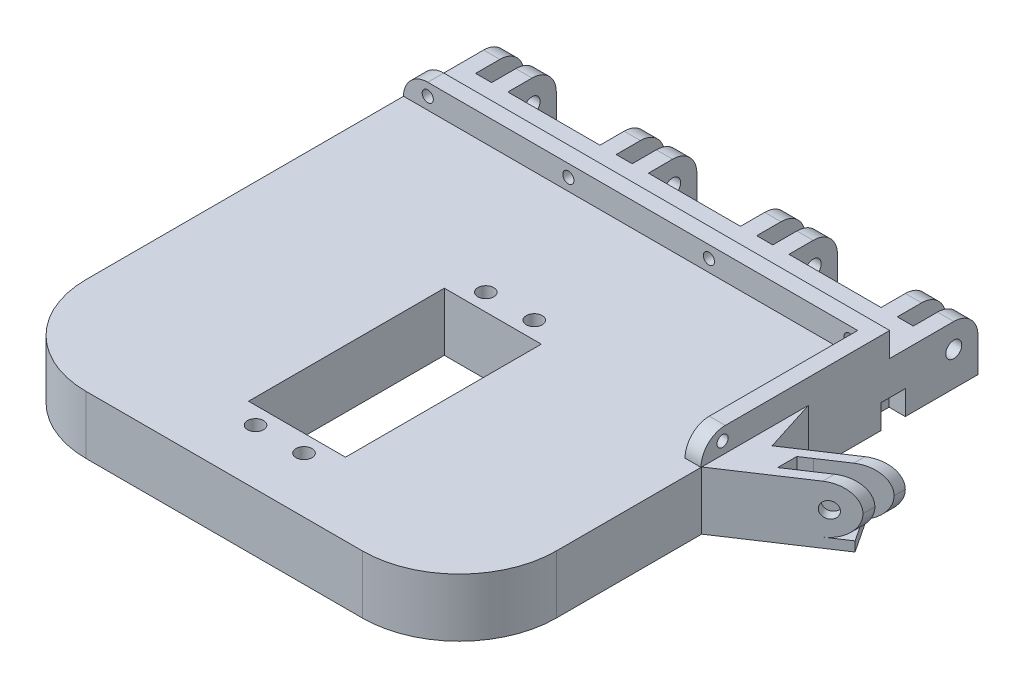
SolidWorks part; units mm, degrees
ref_plane "Front Plane" through (0, 0, 0) normal (0, 0, 1) x (1, 0, 0)
ref_plane "Top Plane" through (0, 0, 0) normal (0, 1, 0) x (1, 0, 0)
ref_plane "Right Plane" through (0, 0, 0) normal (1, 0, 0) x (0, 0, -1)
sketch "Sketch1" plane through (0, 0, 0) normal (0, 1, 0) x (1, 0, 0)
  line L1 (0, 0) -> (97, 0)
  line L2 (0, 0) -> (0, 97)
  line L3 (0, 97) -> (97, 97)
  line L4 (97, 0) -> (97, 97)
  line L5 (38.5, 15) -> (58.5, 15)
  line L6 (38.5, 15) -> (38.5, 55.4)
  line L7 (38.5, 55.4) -> (58.5, 55.4)
  line L8 (58.5, 15) -> (58.5, 55.4)
  circle A0 centre (43.5, 58.95) radius 1.65
  circle A1 centre (53.5, 58.95) radius 1.65
  circle A2 centre (43.5, 11.45) radius 1.65
  circle A3 centre (53.5, 11.45) radius 1.65
  dimension "D7" = 3.55
  dimension "D8" = 3.3
  dimension "D9" = 3.3
  dimension "D11" = 3.3
  dimension "D12" = 3.3
  dimension "D15" = 10
  dimension "D1" = 97
  dimension "D2" = 97
  dimension "D3" = 40.4
  dimension "D4" = 15
  dimension "D5" = 20
  dimension "D6" = 38.5
  dimension "D10" = 3.55
  dimension "D13" = 3.55
  dimension "D14" = 3.55
  dimension "D16" = 10
  dimension "D17" = 5
  dimension "D18" = 5
extrude "Boss-Extrude1" add sketch "Sketch1" along normal blind 10
sketch "Sketch2" plane through (0, 0, -97) normal (0, 0, -1) x (-1, 0, 0)
  line L0 (-97, 0) -> (0, 0) construction
  line L1 (-97, 10) -> (-93.65, 10)
  line L2 (-97, 10) -> (-97, 0)
  line L3 (-97, 0) -> (-93.65, 0)
  line L4 (-93.65, 10) -> (-93.65, 0)
  line L5 (-97, 10) -> (0, 10) construction
  line L6 (-90.35, 10) -> (-87, 10)
  line L7 (-90.35, 10) -> (-90.35, 0)
  line L8 (-90.35, 0) -> (-87, 0)
  line L9 (-87, 10) -> (-87, 0)
  line L11 (-68, 10) -> (-64.65, 10)
  line L12 (-68, 10) -> (-68, 0)
  line L13 (-68, 0) -> (-64.65, 0)
  line L14 (-64.65, 10) -> (-64.65, 0)
  line L15 (-61.35, 10) -> (-58, 10)
  line L16 (-61.35, 10) -> (-61.35, 0)
  line L17 (-61.35, 0) -> (-58, 0)
  line L18 (-58, 10) -> (-58, 0)
  line L19 (-39, 10) -> (-35.65, 10)
  line L20 (-39, 10) -> (-39, 0)
  line L21 (-39, 0) -> (-35.65, 0)
  line L22 (-35.65, 10) -> (-35.65, 0)
  line L23 (-32.35, 10) -> (-29, 10)
  line L24 (-32.35, 10) -> (-32.35, 0)
  line L25 (-32.35, 0) -> (-29, 0)
  line L26 (-29, 10) -> (-29, 0)
  line L27 (0, 10) -> (-3.35, 10)
  line L28 (0, 10) -> (0, 0)
  line L29 (0, 0) -> (-3.35, 0)
  line L30 (-3.35, 10) -> (-3.35, 0)
  line L31 (-6.65, 10) -> (-10, 10)
  line L32 (-6.65, 10) -> (-6.65, 0)
  line L33 (-6.65, 0) -> (-10, 0)
  line L34 (-10, 10) -> (-10, 0)
  dimension "D1" = 3.3
  dimension "D2" = 3.35
  dimension "D3" = 3.35
  dimension "D4" = 19
  dimension "D5" = 3.35
  dimension "D6" = 3.3
  dimension "D7" = 3.35
  dimension "D8" = 19
  dimension "D9" = 3.35
  dimension "D10" = 3.3
  dimension "D11" = 3.35
  dimension "D12" = 3.35
  dimension "D13" = 3.3
  dimension "D14" = 3.35
extrude "Boss-Extrude2" add sketch "Sketch2" along normal blind 10
fillet "Fillet1" radius 5 16 edges at (1.675, 0, -107) (1.675, 10, -107) (8.325, 0, -107) (8.325, 10, -107) (30.675, 0, -107) (30.675, 10, -107) (37.325, 0, -107) (37.325, 10, -107) (59.675, 0, -107) (59.675, 10, -107) (66.325, 0, -107) (66.325, 10, -107) (88.675, 0, -107) (88.675, 10, -107) (95.325, 0, -107) (95.325, 10, -107)
sketch "Sketch3" plane through (97, 0, 0) normal (1, 0, 0) x (0, 0, -1)
  circle A0 centre (102, 5) radius 1.65
  dimension "D1" = 3.3
extrude "Cut-Extrude1" cut sketch "Sketch3" against normal through all both and the other way through all
fillet "Fillet2" radius 20 2 edges at (97, 5, 0) (0, 5, 0)
sketch "Sketch4" plane through (97, 0, 0) normal (1, 0, 0) x (0, 0, -1)
  line L0 (20, 10) -> (102, 10) construction
  line L1 (50, 10) -> (72, 10)
  line L2 (50, 10) -> (50, 0)
  line L3 (50, 0) -> (72, 0)
  line L4 (72, 10) -> (72, 0)
  line L5 (20, 0) -> (102, 0) construction
  line L6 (20, 10) -> (20, 0) construction
  dimension "D1" = 30
  dimension "D2" = 35
extrude "Boss-Extrude3" add sketch "Sketch4" along normal blind 20
sketch "Sketch5" plane through (0, 10, 0) normal (0, 1, 0) x (1, 0, 0)
  line L0 (97, 50) -> (117, 63.2638)
  line L1 (117, 72) -> (117, 50) construction
  line L2 (117, 72) -> (100.48, 61.0441)
  line L3 (100.48, 61.0441) -> (97, 72)
  line L4 (117, 72) -> (97, 72) construction
  line L5 (97, 72) -> (117, 72)
  line L6 (97, 50) -> (117, 50)
  line L7 (117, 50) -> (117, 63.2638)
extrude "Cut-Extrude2" cut sketch "Sketch5" against normal through all both and the other way through all
sketch "Sketch6" plane through (0, 10, 0) normal (0, 1, 0) x (1, 0, 0)
  line L0 (117, 69.6871) -> (107, 63.0557)
  line L1 (117, 72) -> (117, 63.2638) construction
  line L2 (117, 65.7274) -> (107, 59.096)
  line L3 (107, 63.0557) -> (107, 59.096)
  line L4 (97, 50) -> (117, 63.2638) construction
  line L5 (97, 20) -> (97, 50) construction
  line L9 (117, 69.6871) -> (117, 65.7274)
  dimension "D1" = 3.3
  dimension "D2" = 123.55
  dimension "D3" = 123.552
  dimension "D5" = 10
extrude "Cut-Extrude4" cut sketch "Sketch6" against normal through all both and the other way through all
sketch "Sketch7" plane through (6.6002, 0, 9.9522) normal (0.5527, 0, 0.8334) x (0.8334, 0, -0.5527)
  line L0 (132.4715, 0) -> (132.4715, 10) construction
  line L1 (108.473, 10) -> (132.4715, 10) construction
  circle A0 centre (127.4715, 5) radius 1.65
  dimension "D1" = 3.3
  dimension "D2" = 5
  dimension "D3" = 5
extrude "Cut-Extrude5" cut sketch "Sketch7" against normal blind 20 and the other way through all
fillet "Fillet3" radius 5 4 edges at (117, 10, -70.8436) (117, 0, -70.8436) (117, 10, -64.4956) (117, 0, -64.4956)
sketch "Sketch8" plane through (0, 0, 0) normal (0, -1, 0) x (1, 0, 0)
  line L1 (0, -102) -> (97, -102)
  line L2 (0, -102) -> (0, -20)
  line L3 (20, 0) -> (77, 0)
  line L4 (97, -102) -> (97, -20)
  line L5 (38.5, -15) -> (58.5, -15)
  line L6 (38.5, -15) -> (38.5, -55.4)
  line L7 (38.5, -55.4) -> (58.5, -55.4)
  line L8 (58.5, -15) -> (58.5, -55.4)
  arc A0 (20, 0) -> (0, -20) centre (20, -20) ccw
  arc A1 (97, -20) -> (77, 0) centre (77, -20) ccw
  dimension "D3" = 40
  dimension "D6" = 20
  dimension "D8" = 40
  dimension "D2" = 97
  dimension "D4" = 20
  dimension "D5" = 20
  dimension "D7" = 20
extrude "Boss-Extrude4" add sketch "Sketch8" along normal blind 2
sketch "Sketch9" plane through (0, 0, 0) normal (0, 1, 0) x (1, 0, 0)
  circle A0 centre (53.5, 58.95) radius 1.65
  circle A1 centre (53.5, 58.95) radius 1.65 construction
  circle A2 centre (43.5, 58.95) radius 1.65
  dimension "D1" = 3.3
  dimension "D3" = 3.3
  dimension "D2" = 0
extrude "Cut-Extrude6" cut sketch "Sketch9" against normal blind 2
sketch "Sketch10" plane through (0, 0, -102) normal (0, 0, -1) x (-1, 0, 0)
  line L1 (-97, 0) -> (0, 0)
  line L2 (-97, 0) -> (-97, -2)
  line L3 (-97, -2) -> (0, -2)
  line L4 (0, 0) -> (0, -2)
extrude "Boss-Extrude5" add sketch "Sketch10" along normal blind 5
sketch "Sketch11" plane through (0, 0, 0) normal (0, -1, 0) x (1, 0, 0)
  line L0 (97, -50) -> (97, -72)
  line L1 (97, -72) -> (100.48, -61.0441)
  line L2 (100.48, -61.0441) -> (112, -68.6841)
  line L3 (112, -68.6841) -> (116.0239, -62.6165)
  line L4 (117, -63.2638) -> (112, -59.9478) construction
  line L5 (116.0239, -62.6165) -> (97, -50)
extrude "Boss-Extrude6" add sketch "Sketch11" along normal blind 2
sketch "Sketch12" plane through (0, -2, 0) normal (0, -1, 0) x (1, 0, 0)
  line L0 (97, -107) -> (97, -72) construction
  line L1 (87, -87) -> (90.35, -87)
  line L2 (87, -87) -> (87, -92)
  line L3 (87, -92) -> (90.35, -92)
  line L4 (90.35, -87) -> (90.35, -92)
  line L5 (93.65, -87) -> (97, -87)
  line L6 (93.65, -87) -> (93.65, -92)
  line L7 (93.65, -92) -> (97, -92)
  line L8 (97, -87) -> (97, -92)
  line L9 (97, -107) -> (0, -107) construction
  point P12 (95.325, -87)
  dimension "D1" = 15
  dimension "D2" = 3.35
  dimension "D3" = 5
  dimension "D4" = 15
  dimension "D5" = 5
  dimension "D6" = 3.35
  dimension "D7" = 3.3
extrude "Cut-Extrude7" cut sketch "Sketch12" against normal blind 5
sketch "Sketch13" plane through (93.65, 0, 0) normal (1, 0, 0) x (0, 0, -1)
  line L0 (87, -2) -> (92, -2) construction
  line L1 (92, 3) -> (92, -2) construction
  circle A0 centre (89.5, 0.5) radius 1.15
  dimension "D1" = 2.5
  dimension "D3" = 2.3
  dimension "D2" = 2.5
extrude "Cut-Extrude8" cut sketch "Sketch13" against normal blind 5
pattern_linear "LPattern1" count 4 spacing 29 along (-1, 0, 0) of "Cut-Extrude7"
sketch "Sketch14" plane through (61.35, 0, 0) normal (-1, 0, 0) x (0, 0, 1)
  line L0 (-92, -2) -> (-87, -2) construction
  line L1 (-87, 3) -> (-87, -2) construction
  circle A0 centre (-89.5, 0.5) radius 1.15
  dimension "D1" = 2.3
  dimension "D2" = 2.5
  dimension "D3" = 2.5
extrude "Cut-Extrude10" cut sketch "Sketch14" against normal blind 4
sketch "Sketch15" plane through (32.35, 0, 0) normal (-1, 0, 0) x (0, 0, 1)
  line L0 (-92, -2) -> (-87, -2) construction
  line L1 (-87, 3) -> (-87, -2) construction
  circle A0 centre (-89.5, 0.5) radius 1.15
  dimension "D1" = 2.3
  dimension "D2" = 2.5
  dimension "D3" = 2.5
extrude "Cut-Extrude11" cut sketch "Sketch15" against normal blind 5
sketch "Sketch16" plane through (3.35, 0, 0) normal (-1, 0, 0) x (0, 0, 1)
  line L0 (-92, -2) -> (-87, -2) construction
  line L1 (-87, 3) -> (-87, -2) construction
  circle A0 centre (-89.5, 0.5) radius 1.15
  dimension "D1" = 2.3
  dimension "D2" = 2.5
  dimension "D3" = 2.5
extrude "Cut-Extrude12" cut sketch "Sketch16" against normal blind 5
sketch "Sketch17" plane through (0, 0, 0) normal (0, 1, 0) x (1, 0, 0)
  line L0 (97, 72) -> (97, 102) construction
  line L1 (0, 107) -> (3.35, 107)
  line L2 (0, 107) -> (0, 97)
  line L3 (0, 97) -> (3.35, 97)
  line L4 (3.35, 107) -> (3.35, 97)
  line L5 (6.65, 107) -> (10, 107)
  line L6 (6.65, 107) -> (6.65, 97)
  line L7 (6.65, 97) -> (10, 97)
  line L8 (10, 107) -> (10, 97)
  line L9 (29, 107) -> (32.35, 107)
  line L10 (29, 107) -> (29, 97)
  line L11 (29, 97) -> (32.35, 97)
  line L12 (32.35, 107) -> (32.35, 97)
  line L13 (35.65, 107) -> (39, 107)
  line L14 (35.65, 107) -> (35.65, 97)
  line L15 (35.65, 97) -> (39, 97)
  line L16 (39, 107) -> (39, 97)
  line L17 (58, 107) -> (61.35, 107)
  line L18 (58, 107) -> (58, 97)
  line L19 (58, 97) -> (61.35, 97)
  line L20 (61.35, 107) -> (61.35, 97)
  line L21 (64.65, 107) -> (68, 107)
  line L22 (64.65, 107) -> (64.65, 97)
  line L23 (64.65, 97) -> (68, 97)
  line L24 (68, 107) -> (68, 97)
  line L25 (87, 107) -> (90.35, 107)
  line L26 (87, 107) -> (87, 97)
  line L27 (87, 97) -> (90.35, 97)
  line L28 (90.35, 107) -> (90.35, 97)
  line L29 (93.65, 107) -> (97, 107)
  line L30 (93.65, 107) -> (93.65, 97)
  line L31 (93.65, 97) -> (97, 97)
  line L32 (97, 107) -> (97, 97)
extrude "Boss-Extrude7" add sketch "Sketch17" along normal up to next
sketch "Sketch19" plane through (0, -2, 0) normal (0, -1, 0) x (1, 0, 0)
  line L0 (90.9919, -46.0155) -> (89.8865, -47.6823)
  line L1 (89.8865, -47.6823) -> (85.7196, -44.9188)
  line L2 (85.7196, -44.9188) -> (86.825, -43.252)
  line L3 (86.825, -43.252) -> (90.9919, -46.0155)
  line L4 (116.0239, -62.6165) -> (97, -50) construction
  line L5 (88.5767, -50.0048) -> (84.3333, -47.1907)
  line L6 (84.3333, -47.1907) -> (83.2279, -48.8574)
  line L7 (83.2279, -48.8574) -> (87.4713, -51.6716)
  line L8 (87.4713, -51.6716) -> (88.5767, -50.0048)
  line L9 (100.48, -61.0441) -> (112, -68.6841) construction
  dimension "D1" = 2
  dimension "D2" = 0
  dimension "D3" = 5
  dimension "D4" = 180
  dimension "D5" = 2
extrude "Cut-Extrude13" cut sketch "Sketch19" against normal blind 5
sketch "Sketch20" plane through (4.0249, 0, 6.069) normal (-0.5527, 0, -0.8334) x (-0.8334, 0, 0.5527)
  line L0 (-91.6401, 0) -> (-107.4744, 0) construction
  circle A0 centre (-98.7791, 0) radius 1.15
  dimension "D1" = 2.3
sketch "Sketch21" plane through (5.4948, 0, 8.2854) normal (0.5527, 0, 0.8334) x (0.8334, 0, -0.5527)
  line L0 (108.473, -2) -> (91.8922, -2) construction
  circle A0 centre (98.4404, 0.5) radius 1.15
  dimension "D1" = 2.3
  dimension "D2" = 2.5
extrude "Cut-Extrude15" cut sketch "Sketch21" against normal blind 3
sketch "Sketch23" plane through (0, 10, 0) normal (0, 1, 0) x (1, 0, 0)
  line L0 (0, 102) -> (0, 20) construction
  line L1 (0, 88.7796) -> (97, 88.7796)
  line L2 (0, 88.7796) -> (0, 85.4796)
  line L3 (0, 85.4796) -> (97, 85.4796)
  line L4 (97, 88.7796) -> (97, 85.4796)
  line L5 (97, 72) -> (97, 102) construction
  dimension "D1" = 3.3
extrude "Boss-Extrude9" add sketch "Sketch23" along normal blind 5
sketch "Sketch24" plane through (0, 0, -85.4796) normal (0, 0, 1) x (1, 0, 0)
  line L0 (0, 15) -> (0, 10) construction
  line L1 (0, 10) -> (97, 10) construction
  line L2 (0, 15) -> (97, 15) construction
  circle A0 centre (5, 12.5) radius 1.15
  circle A1 centre (34, 12.5) radius 1.15
  circle A2 centre (63, 12.5) radius 1.15
  circle A3 centre (92, 12.5) radius 1.15
  dimension "D3" = 2.3
  dimension "D5" = 2.3
  dimension "D6" = 2.5
  dimension "D8" = 2.3
  dimension "D9" = 2.5
  dimension "D11" = 2.3
  dimension "D1" = 5
  dimension "D2" = 2.5
  dimension "D4" = 29
  dimension "D7" = 29
  dimension "D10" = 29
  dimension "D12" = 2.5
extrude "Cut-Extrude16" cut sketch "Sketch24" against normal blind 5
sketch "Sketch25" plane through (0, 10, 0) normal (0, 1, 0) x (1, 0, 0)
  line L1 (97, 85.4796) -> (93.7, 85.4796)
  line L2 (97, 85.4796) -> (97, 49.86)
  line L3 (97, 49.86) -> (93.7, 49.86)
  line L4 (93.7, 85.4796) -> (93.7, 49.86)
  dimension "D1" = 3.3
extrude "Boss-Extrude10" add sketch "Sketch25" along normal blind 5
sketch "Sketch26" plane through (97, 0, 0) normal (1, 0, 0) x (0, 0, -1)
  line L1 (49.86, 15) -> (88.7796, 15) construction
  circle A0 centre (54.3036, 12.5) radius 1.15
  dimension "D1" = 2.3
  dimension "D2" = 2.5
extrude "Cut-Extrude17" cut sketch "Sketch26" against normal blind 5
fillet "Fillet4" radius 5 1 edges at (95.35, 15, -49.86)
fillet "Fillet5" radius 5 1 edges at (0, 15, -87.1296)
sketch "Sketch27" plane through (0, 10, 0) normal (0, 1, 0) x (1, 0, 0)
  line L0 (107, 63.0557) -> (107, 59.096)
  line L1 (107, 59.096) -> (104.9321, 57.7246)
  line L2 (104.9321, 57.7246) -> (104.9321, 61.6843)
  line L3 (104.9321, 61.6843) -> (107, 63.0557)
  line L4 (97, 50) -> (112, 59.9478) construction
  line L5 (112, 68.6841) -> (100.48, 61.0441) construction
  dimension "D1" = 0
  dimension "D2" = 0
extrude "Cut-Extrude18" cut sketch "Sketch27" against normal blind 10
equation "\"ˇ2\"=20"
